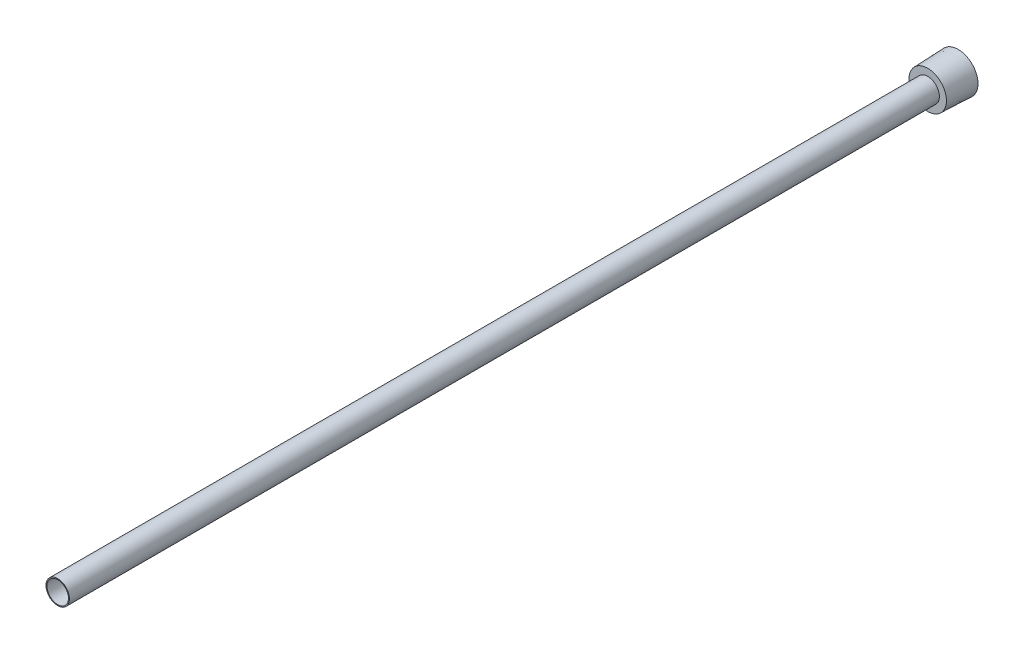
SolidWorks part; units mm, degrees
ref_plane "Front Plane" through (0, 0, 0) normal (0, 0, 1) x (1, 0, 0)
ref_plane "Top Plane" through (0, 0, 0) normal (0, 1, 0) x (1, 0, 0)
ref_plane "Right Plane" through (0, 0, 0) normal (1, 0, 0) x (0, 0, -1)
sketch "Sketch1" plane through (0, 0, 0) normal (1, 0, 0) x (0, 0, -1)
  line L0 (-331.1242, 0) -> (49668.8758, 0) construction
  line L1 (0, 0) -> (-304.8, 0)
  line L6 (0, 0) -> (0, 6.7183)
  line L7 (0, 6.7183) -> (-10.3124, 6.3421)
  line L8 (-10.3124, 3.9688) -> (-304.8, 3.9687)
  line L9 (-10.3124, 6.3421) -> (-10.3124, 3.9688)
  line L10 (-304.8, 3.9687) -> (-304.8, 0)
  dimension "D1" = 7.9375
  dimension "D2" = 10.3124
  dimension "D3" = 2.089
  dimension "D4" = 13.4366
  dimension "D5" = 304.8
revolve "Revolve1" add sketch "Sketch1" angle 360 about L0
sketch "Sketch2" plane through (0, 0, 304.8) normal (0, 0, 1) x (1, 0, 0)
  circle A0 centre (0, 0) radius 3.6512
  dimension "D1" = 7.3025
extrude "Cut-Extrude1" cut sketch "Sketch2" against normal through all
sketch "Sketch3" plane through (0, 0, 0) normal (0, 0, -1) x (-1, 0, 0)
  line L0 (0, 7.3901) -> (0, -7.3901) construction
  line L1 (-4.7625, -2.7496) -> (0, -5.4993)
  line L2 (0, -5.4993) -> (4.7625, -2.7496)
  line L3 (4.7625, -2.7496) -> (4.7625, 2.7496)
  line L4 (4.7625, 2.7496) -> (0, 5.4993)
  line L5 (0, 5.4993) -> (-4.7625, 2.7496)
  line L6 (-4.7625, 2.7496) -> (-4.7625, -2.7496)
  circle A0 centre (0, 0) radius 4.7625 construction
  dimension "D1" = 9.525
extrude "Cut-Extrude2" cut sketch "Sketch3" against normal blind 6.35
